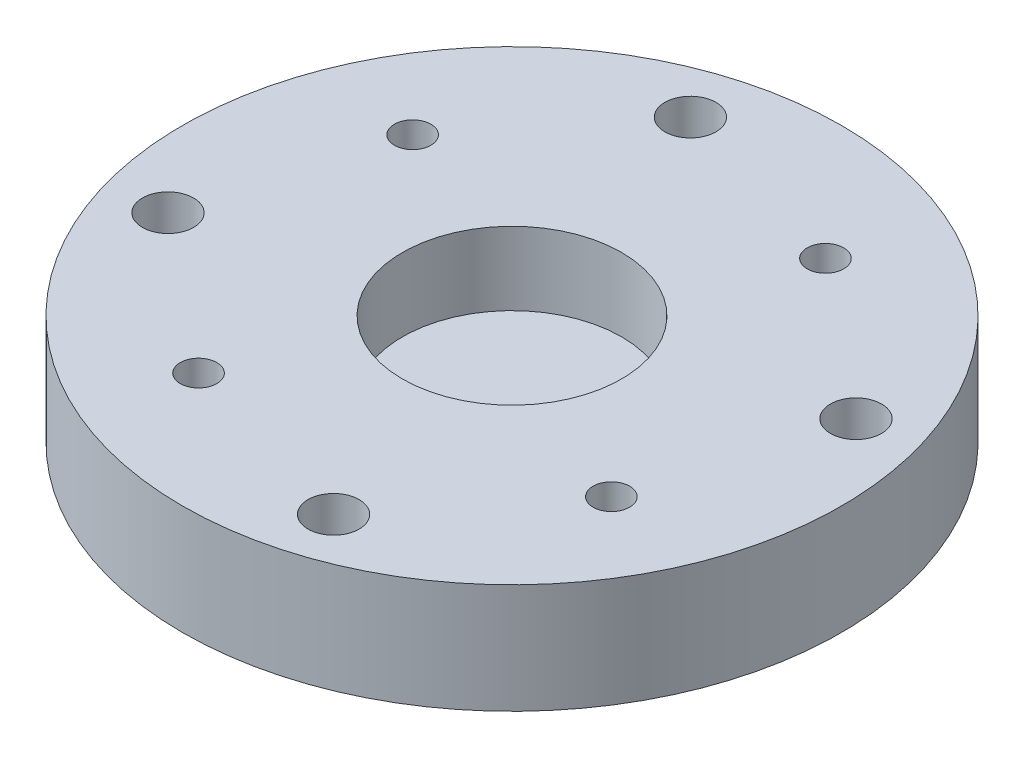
SolidWorks part; units mm, degrees
ref_plane "Plan de face" through (0, 0, 0) normal (0, 0, 1) x (1, 0, 0)
ref_plane "Plan de dessus" through (0, 0, 0) normal (0, 1, 0) x (1, 0, 0)
ref_plane "Plan de droite" through (0, 0, 0) normal (1, 0, 0) x (0, 0, -1)
sketch "Esquisse1" plane through (0, 0, 0) normal (0, 0, 1) x (1, 0, 0)
  line L0 (0, 28.1712) -> (0, -16.4856) construction
  line L1 (0, 0) -> (45.1, 0)
  line L2 (45.1, 0) -> (45.1, 15)
  line L3 (45.1, 15) -> (15, 15)
  line L4 (15, 15) -> (15, 5)
  line L5 (15, 5) -> (0, 5)
  line L6 (0, 5) -> (0, 0)
  dimension "D1" = 15
  dimension "D2" = 15
  dimension "D3" = 10
  dimension "D4" = 45.1
revolve "Révolution1" add sketch "Esquisse1" angle 360 about L0
hole_wizard "Perçage1" positions "Esquisse3" profile "Esquisse2" legacy
sketch "Esquisse3" plane through (0, 0, 0) normal (0, -1, 0) x (1, 0, 0)
  circle A0 centre (0, 0) radius 37.5
  point P0 (-35.7471, 11.3312)
  dimension "D1" = 75
sketch "Esquisse2" plane through (-35.7471, 0, 11.3312) normal (1, 0, 0) x (0, 0, -1)
  line L0 (0, 0) -> (0, 15)
  line L1 (0, 15) -> (3.5, 15)
  line L3 (3.5, 15) -> (3.5, 7)
  line L4 (3.5, 7) -> (6, 7)
  line L5 (6, 7) -> (6, 0)
  line L7 (6, 0) -> (0, 0)
  line L11 (0, -6.35) -> (0, 107.95) construction
  dimension "Diamètre du perçage jusqu'au prochain" = 7
  dimension "Profondeur du perçage jusqu'au prochain" = 15
  dimension "Diamètre du chambrage" = 12
  dimension "Profondeur du chambrage" = 7
pattern_circular "Répétition circulaire1" count 4 every 90 about axis through (0, 0, 0) along (0, 1, 0) of "Perçage1"
hole_wizard "Trou taraudé M61" positions "Esquisse12" profile "Esquisse11" tap size "M6" standard "ISO"
sketch "Esquisse12" plane through (0, 0, 0) normal (0, -1, 0) x (1, 0, 0)
  line L0 (0, 0) -> (11.3312, 35.7471) construction
  line L1 (0, 0) -> (-35.7471, 11.3312) construction
  point P0 (-14.6496, 28.247)
  dimension "D1" = 22.5
  dimension "D2" = 22.5
sketch "Esquisse11" plane through (-14.6496, 0, 28.247) normal (1, 0, 0) x (0, 0, -1)
  line L0 (0, 0) -> (0, 15)
  line L1 (0, 15) -> (2.5, 15)
  line L2 (2.5, 15) -> (2.5, 0)
  line L5 (2.5, 0) -> (0, 0)
  line L11 (0, -6.35) -> (0, 107.95) construction
  dimension "Diamètre du trou pour taraudage jusqu'au prochain" = 5
  dimension "Profondeur du trou pour taraudage jusqu'au prochain" = 15
pattern_circular "Répétition circulaire3" count 4 every 90 about axis through (0, 0, 0) along (0, 1, 0) of "Trou taraudé M61"
